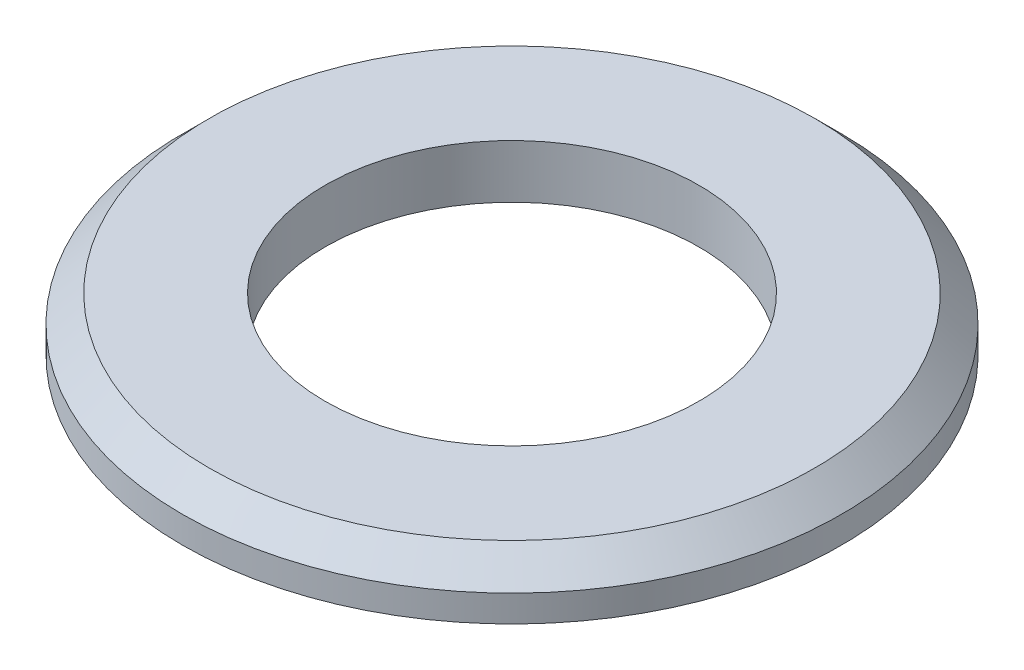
SolidWorks part; units mm, degrees
ref_plane "Front" through (0, 0, 0) normal (0, 0, 1) x (1, 0, 0)
ref_plane "Top" through (0, 0, 0) normal (0, 1, 0) x (1, 0, 0)
ref_plane "Right" through (0, 0, 0) normal (1, 0, 0) x (0, 0, -1)
sketch "Sketch1" plane through (0, 0, 0) normal (0, 1, 0) x (1, 0, 0)
  circle A0 centre (0, 0) radius 10.5
  circle A1 centre (0, 0) radius 18.5
extrude "Extrude1" add sketch "Sketch1" along normal blind 3
chamfer "Chamfer1" distance 1.5 1 edges at (0, 3, 18.5)
